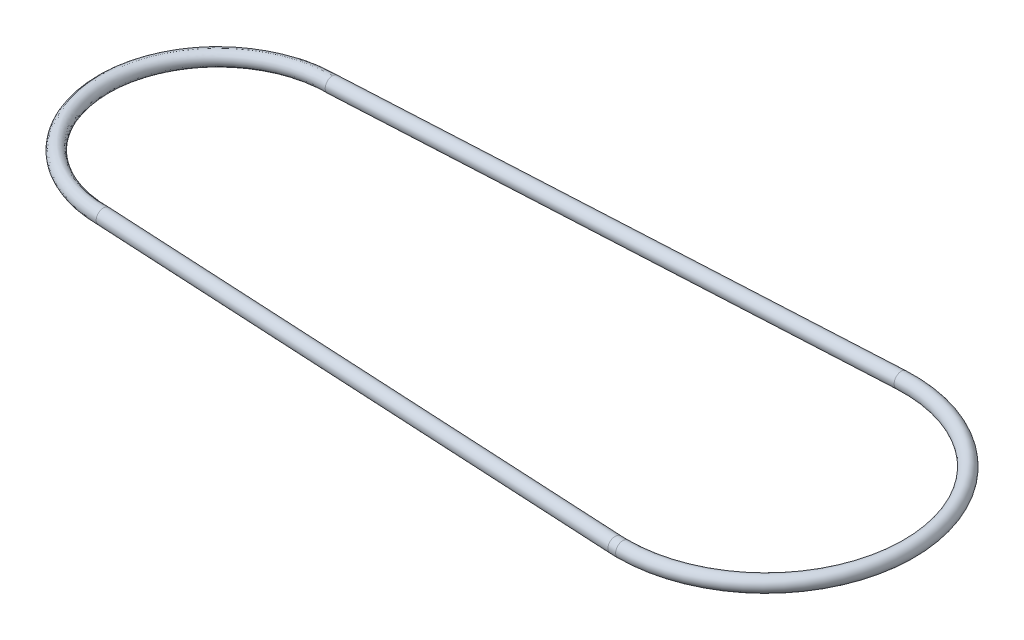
SolidWorks part; units mm, degrees
ref_plane "Front Plane" through (0, 0, 0) normal (0, 0, 1) x (1, 0, 0)
ref_plane "Top Plane" through (0, 0, 0) normal (0, 1, 0) x (1, 0, 0)
ref_plane "Right Plane" through (0, 0, 0) normal (1, 0, 0) x (0, 0, -1)
sketch "Sketch3" plane through (0, 0, 0) normal (1, 0, 0) x (0, 0, -1)
  circle A0 centre (-30, 0) radius 1.524
  dimension "D1" = 3.048
  dimension "1.25" = 30
sketch "Sketch4" plane through (0, 0, 0) normal (0, 1, 0) x (1, 0, 0)
  line L8 (-115, 24) -> (-1.5738, 29.9587)
  line L9 (-115, -24) -> (-1.5738, -29.9587)
  arc A12 (-115, 24) -> (-115, -24) centre (-115, 0) ccw
  arc A13 (-1.5738, -29.9587) -> (-1.5738, 29.9587) centre (0, 0) ccw
  dimension "D1" = 24
  dimension "D2" = 30
  dimension "D3" = 115
sweep "Sweep2" add profiles "Sketch3" path "Sketch4"
ref_plane "Plane4" through (-115, 0, 0) normal (1, 0, 0) x (0, 0, -1)
